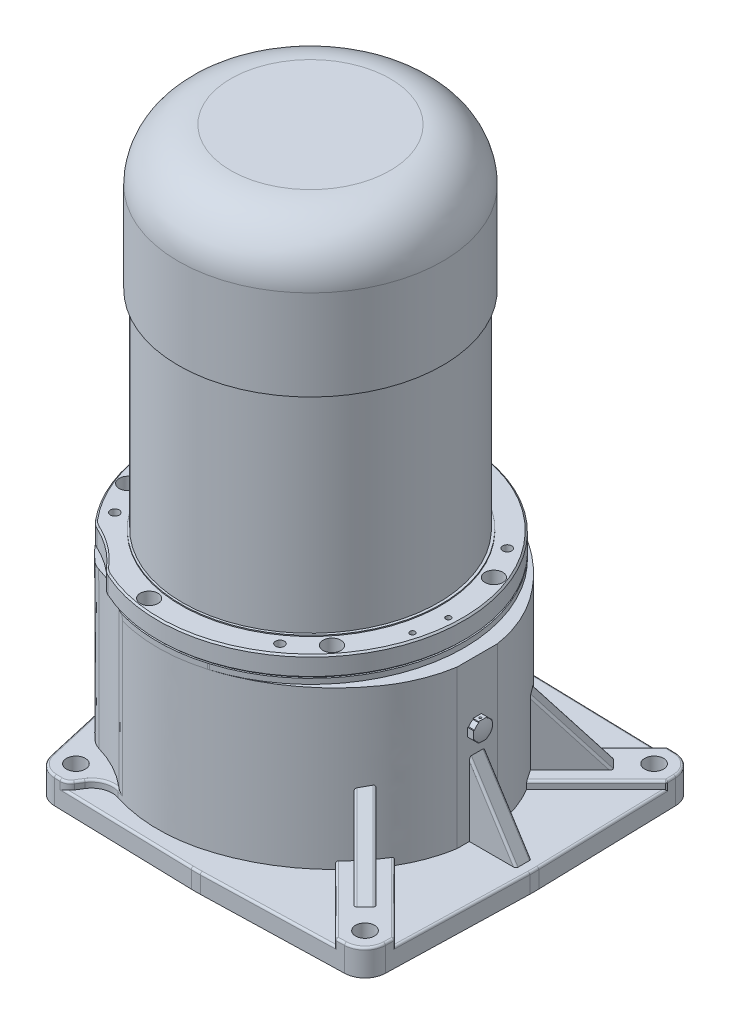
SolidWorks part; units mm, degrees
ref_plane "前视基准面" through (0, 0, 0) normal (0, 0, 1) x (1, 0, 0)
ref_plane "上视基准面" through (0, 0, 0) normal (0, 1, 0) x (1, 0, 0)
ref_plane "右视基准面" through (0, 0, 0) normal (1, 0, 0) x (0, 0, -1)
imported_body "50箱盖-1-surface1"
imported_body "复件 5034.2200.106-00-1-surface1"
imported_body "复件 5034.2200.106-00-1-surface2"
imported_body "复件 5034.2200.106-00-1-surface3"
imported_body "复件 5034.2200.106-00-1-surface4"
imported_body "复件 5034.2200.106-00-1-surface5"
imported_body "复件 5034.2200.106-00-1-surface6"
imported_body "复件 5034.2200.106-00-1-surface7"
imported_body "复件 5034.2200.106-00-1-surface8"
imported_body "复件 5034.2200.106-00-1-surface9"
imported_body "复件 5034.2200.106-00-1-surface10"
imported_body "复件 5034.2200.106-00-1-surface11"
imported_body "复件 5034.2200.106-00-1-surface13"
imported_body "复件 5034.2200.106-00-1-surface14"
imported_body "复件 5034.2200.106-00-1-surface15"
imported_body "复件 5034.2200.106-00-1-surface16"
imported_body "复件 5034.2200.106-00-1-surface17"
imported_body "复件 5034.2200.106-00-1-surface18"
imported_body "复件 5034.2200.106-00-1-surface19"
imported_body "复件 5034.2200.106-00-1-surface20"
imported_body "复件 5034.2200.106-00-1-surface21"
imported_body "复件 5034.2200.106-00-1-surface22"
imported_body "复件 5034.2200.106-00-1-surface23"
imported_body "复件 5034.2200.106-00-1-surface24"
imported_body "复件 5034.2200.106-00-1-surface25"
imported_body "复件 5034.2200.106-00-1-surface26"
imported_body "复件 5034.2200.106-00-1-surface27"
imported_body "复件 5034.2200.106-00-1-surface28"
imported_body "复件 5034.2200.106-00-1-surface29"
imported_body "复件 5034.2200.106-00-1-surface30"
imported_body "复件 5034.2200.106-00-1-surface31"
imported_body "复件 5034.2200.106-00-1-surface32"
imported_body "复件 5034.2200.106-00-1-surface33"
imported_body "复件 5034.2200.106-00-1-surface34"
imported_body "复件 5034.2200.106-00-1-surface35"
imported_body "复件 5034.2200.106-00-1-surface36"
imported_body "复件 5034.2200.106-00-1-surface37"
imported_body "复件 5034.2200.106-00-1-surface38"
imported_body "复件 5034.2200.106-00-1-surface39"
imported_body "复件 5034.2200.106-00-1-surface40"
imported_body "复件 5034.2200.106-00-1-surface41"
imported_body "复件 5034.2200.106-00-1-surface42"
imported_body "复件 5034.2200.106-00-1-surface43"
imported_body "复件 5034.2200.106-00-1-surface44"
imported_body "复件 5034.2200.106-00-1-surface45"
imported_body "复件 5034.2200.106-00-1-surface46"
imported_body "复件 5034.2200.106-00-1-surface47"
imported_body "复件 5034.2200.106-00-1-surface48"
imported_body "复件 5034.2200.106-00-1-surface49"
imported_body "复件 5034.2200.106-00-1-surface50"
imported_body "复件 5034.2200.106-00-1-surface51"
imported_body "复件 5034.2200.106-00-1-surface52"
imported_body "复件 5034.2200.106-00-1-surface53"
imported_body "复件 5034.2200.106-00-1-surface54"
imported_body "复件 5034.2200.106-00-1-surface55"
imported_body "复件 5034.2200.106-00-1-surface56"
imported_body "复件 5034.2200.106-00-1-surface57"
imported_body "复件 5034.2200.106-00-1-surface58"
imported_body "立式箱体-2-surface1"
imported_body "立式箱体-2-surface2"
imported_body "立式箱体-2-surface3"
imported_body "透气塞-1-surface1"
sketch "草图3" plane through (0, -196.7551, 0) normal (0, 1, 0) x (1, 0, 0)
  circle A0 centre (15.5509, 127.454) radius 122
  circle A1 centre (67.5509, 127.454) radius 52 construction
extrude "凸台-拉伸1" add sketch "草图3" along normal blind 199
sketch "草图4" plane through (0, 2.2449, 0) normal (0, 1, 0) x (1, 0, 0)
  circle A0 centre (15.5509, 127.454) radius 126
extrude "凸台-拉伸2" add sketch "草图4" along normal blind 136
fillet "圆角1" radius 50 1 edges at (15.5509, 138.2449, -1.454)
